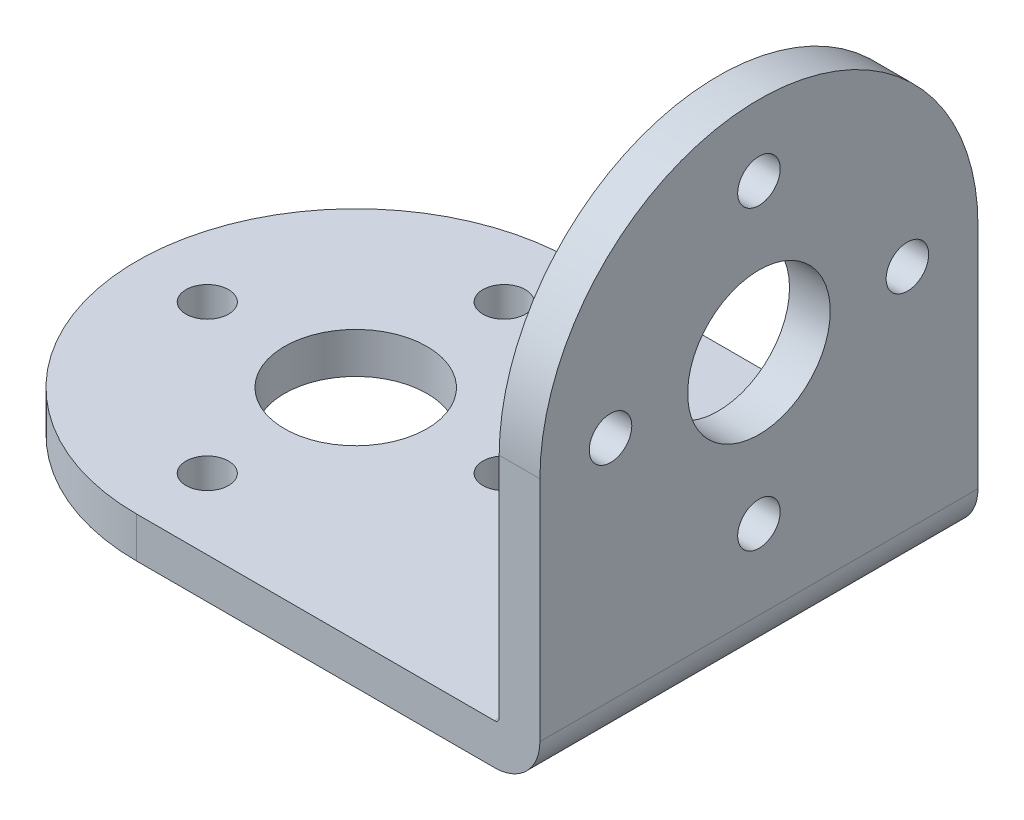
SolidWorks part; units mm, degrees
ref_plane "Front" through (0, 0, 0) normal (0, 0, 1) x (1, 0, 0)
ref_plane "Top" through (0, 0, 0) normal (0, 1, 0) x (1, 0, 0)
ref_plane "Right" through (0, 0, 0) normal (1, 0, 0) x (0, 0, -1)
sketch "Sketch1" plane through (0, 0, 0) normal (0, 1, 0) x (1, 0, 0)
  line L0 (-22.6314, 12.2936) -> (0, 12.2936)
  line L2 (0, 12.2936) -> (0, -12.2936)
  line L3 (0, -12.2936) -> (-22.6314, -12.2936)
  circle A12 centre (-22.6314, 0) radius 4.0005
  circle A13 centre (-22.6314, -8.3312) radius 1.1938
  circle A14 centre (-30.9626, 0) radius 1.1938
  circle A15 centre (-14.3002, 0) radius 1.1938
  arc A16 (-22.6314, -12.2936) -> (-22.6314, 12.2936) centre (-22.6314, 0) cw
  circle A17 centre (-22.6314, 8.3312) radius 1.1938
sketch "Sketch2" plane through (0, 0, 0) normal (1, 0, 0) x (0, 0, -1)
  line L1 (-12.2936, 15.3162) -> (-12.2936, 0)
  line L2 (-12.2936, 0) -> (12.2936, 0)
  line L3 (12.2936, 0) -> (-12.2936, 0) construction
  line L4 (12.2936, 0) -> (-12.2936, 0) construction
  line L5 (12.2936, 0) -> (12.2936, 15.3162)
  arc A0 (12.2936, 15.3162) -> (-12.2936, 15.3162) centre (0, 15.3162) ccw
  circle A1 centre (0, 15.3162) radius 4.0005
  circle A2 centre (-8.3312, 15.3162) radius 1.1938
  circle A3 centre (0, 23.6474) radius 1.1938
  circle A4 centre (8.3312, 15.3162) radius 1.1938
  circle A5 centre (0, 6.985) radius 1.1938
extrude "Extrude1" add sketch "Sketch1" along normal blind 2.286
extrude "Extrude2" add sketch "Sketch2" against normal blind 2.286
fillet "Fillet1" radius 0.254 1 edges at (-2.286, 2.286, 0)
fillet "Fillet2" radius 2.54 1 edges at (0, 0, 0)
